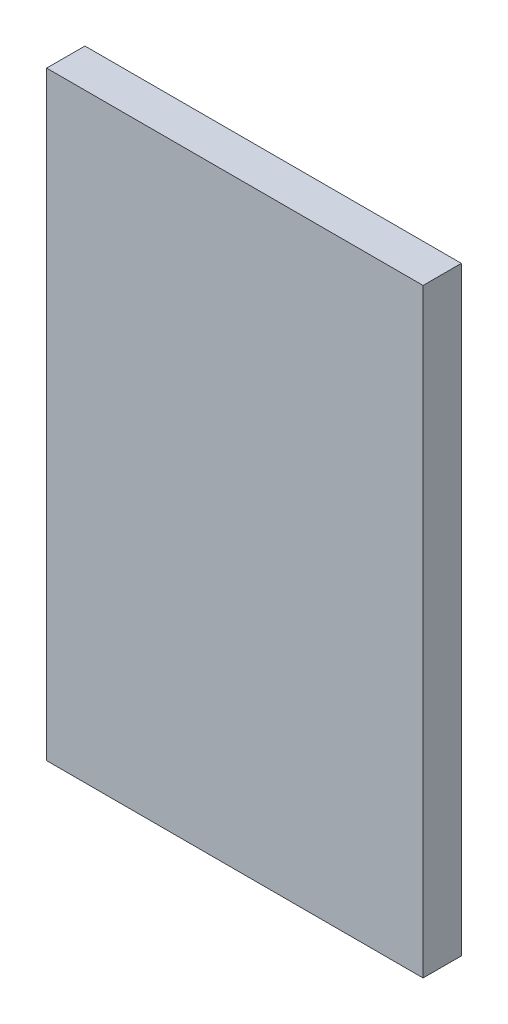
SolidWorks part; units mm, degrees
ref_plane "Plan de face" through (0, 0, 0) normal (0, 0, 1) x (1, 0, 0)
ref_plane "Plan de dessus" through (0, 0, 0) normal (0, 1, 0) x (1, 0, 0)
ref_plane "Plan de droite" through (0, 0, 0) normal (1, 0, 0) x (0, 0, -1)
sketch "Esquisse1" plane through (0, 0, 0) normal (0, 0, 1) x (1, 0, 0)
  line L1 (-14.75, 23.5) -> (14.75, 23.5)
  line L2 (-14.75, 23.5) -> (-14.75, -23.5)
  line L3 (-14.75, -23.5) -> (14.75, -23.5)
  line L4 (14.75, 23.5) -> (14.75, -23.5)
  line L5 (-14.75, 23.5) -> (14.75, -23.5) construction
  line L6 (-14.75, -23.5) -> (14.75, 23.5) construction
  point P0 (0, 0)
  dimension "D1" = 47
  dimension "D2" = 29.5
extrude "Boss.-Extru.1" add sketch "Esquisse1" along normal blind 3
